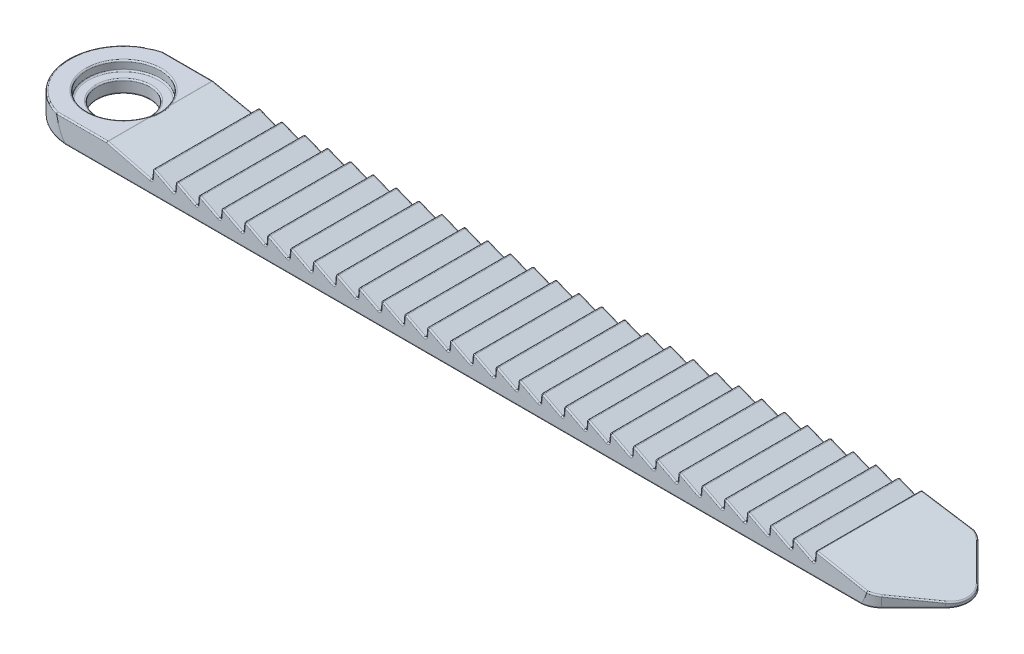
SolidWorks part; units mm, degrees
ref_plane "Face" through (0, 0, 0) normal (0, 0, 1) x (1, 0, 0)
ref_plane "Dessus" through (0, 0, 0) normal (0, 1, 0) x (1, 0, 0)
ref_plane "Droite" through (0, 0, 0) normal (1, 0, 0) x (0, 0, -1)
sketch "Esquisse1" plane through (0, 0, 0) normal (0, 1, 0) x (1, 0, 0)
  line L0 (-22.5776, 0) -> (227.4274, 0) construction
  line L1 (0, 12) -> (172.9289, 12)
  line L2 (176.4645, 10.5355) -> (183.4645, 3.5355)
  line L3 (0, -12) -> (172.9289, -12)
  line L4 (183.4645, -3.5355) -> (176.4645, -10.5355)
  arc A0 (0, 12) -> (0, -12) centre (0, 0) ccw
  arc A1 (183.4645, 3.5355) -> (183.4645, -3.5355) centre (179.9289, 0) cw
  arc A2 (172.9289, 12) -> (176.4645, 10.5355) centre (172.9289, 7) cw
  arc A3 (172.9289, -12) -> (176.4645, -10.5355) centre (172.9289, -7) ccw
  point P11 (187, 0)
  point P14 (175, 12)
  point P17 (175, -12)
  dimension "D3" = 5
  dimension "D1" = 24
  dimension "D2" = 175
extrude "Extrusion1" add sketch "Esquisse1" along normal blind 4.8
sketch "Esquisse2" plane through (0, 0, 0) normal (0, 0, 1) x (1, 0, 0)
  line L0 (8, 4.8) -> (18, 2.5)
  line L1 (0, 4.8) -> (172.9289, 4.8) construction
  line L2 (18, 2.5) -> (18, 4.8)
  line L3 (0, 0) -> (172.9289, 0) construction
  line L4 (8, 4.8) -> (18, 4.8)
  dimension "D1" = 8
  dimension "D2" = 10
  dimension "D3" = 2.5
extrude "Extrusion2" cut sketch "Esquisse2" against normal through all and the other way through all
sketch "Esquisse3" plane through (0, 0, 0) normal (0, 0, 1) x (1, 0, 0)
  line L0 (18, 4.8) -> (172.9289, 4.8) construction
  line L1 (18, 4.8) -> (23, 4.8)
  line L2 (18, 4.8) -> (23, 2.5)
  line L3 (23, 2.5) -> (23, 4.8)
  line L4 (18, 2.5) -> (18, 4.8) construction
  dimension "D1" = 5
extrude "Extrusion3" cut sketch "Esquisse3" against normal through all and the other way through all
pattern_linear "Répétition linéaire1" count 29 spacing 5 along (1, 0, 0) of "Extrusion3"
sketch "Esquisse6" plane through (0, 0, 0) normal (0, 0, 1) x (1, 0, 0)
  line L0 (163, 4.8) -> (184.9289, 1)
  line L1 (184.9289, 0) -> (184.9289, 4.8) construction
  line L2 (176.4645, 0) -> (183.4645, 0) construction
  line L3 (163, 4.8) -> (184.9289, 4.8)
  line L4 (184.9289, 4.8) -> (184.9289, 1)
  dimension "D1" = 1
extrude "Extrusion4" cut sketch "Esquisse6" against normal through all and the other way through all
sketch "Esquisse7" plane through (0, 0, 0) normal (1, 0, 0) x (0, 0, -1)
  line L0 (12, 0) -> (11.5801, 4.8)
  line L1 (-12, 0) -> (-11.5801, 4.8)
  line L2 (12, 4.8) -> (-12, 4.8) construction
  line L3 (12, 4.8) -> (11.5801, 4.8)
  line L4 (12, 4.8) -> (12, 0) construction
  line L5 (12, 4.8) -> (12, 0)
  line L6 (-12, 4.8) -> (-12, 0) construction
  line L7 (-12, 4.8) -> (-12, 0)
  line L8 (-11.5801, 4.8) -> (-12, 4.8)
  dimension "D1" = 5
  dimension "D2" = 5
extrude "Extrusion5" cut sketch "Esquisse7" against normal through all and the other way through all
hole_wizard "Perçage1" positions "Esquisse9" profile "Esquisse8" legacy
sketch "Esquisse9" plane through (0, 4.8, 0) normal (0, 1, 0) x (-1, 0, 0)
  point P0 (0, 0)
sketch "Esquisse8" plane through (0, 4.8, 0) normal (1, 0, 0) x (0, 0, 1)
  line L0 (0, 0) -> (0, 8.2549)
  line L1 (0, 8.2549) -> (5.75, 4.8)
  line L2 (5.75, 4.8) -> (5.75, 2)
  line L3 (5.75, 2) -> (8, 2)
  line L4 (8, 0) -> (0, 0)
  line L5 (0, -11.3109) -> (0, 121.1557) construction
  line L6 (0, 8.2549) -> (-5.75, 4.8) construction
  line L7 (8, 2) -> (8, 0)
  dimension "Diamètre" = 11.5
  dimension "Profondeur" = 4.8
  dimension "Diamètre chambrage" = 16
  dimension "Profondeur chambrage" = 2
  dimension "Angle" = 118
fillet "Congé1" radius 0.3 9 edges at (179.9645, 0, -7.0355) (174.8423, 0, -11.6194) (86.4645, 0, -12) (-12, 0, 0) (86.4645, 0, 12) (174.8423, 0, 11.6194) (179.9645, 0, 7.0355) (184.9289, 0, 0) (0, 0, 5.75)
fillet "Congé2" radius 0.3 71 edges at (33, 3.65, 11.6807) (23, 3.65, 11.6807) (18, 3.65, 11.6807) (25.5, 3.65, 11.6807) (23, 4.8, 0) (23, 2.5, 0) (18, 2.5, 0) (123, 3.65, -11.6807) (118, 3.65, -11.6807) (113, 3.65, -11.6807) (108, 3.65, -11.6807) (108, 3.65, 11.6807) (103, 3.65, -11.6807) (103, 3.65, 11.6807) (98, 3.65, -11.6807) (83, 3.65, -11.6807) (73, 3.65, 11.6807) (63, 3.65, -11.6807) (58, 3.65, 11.6807) (53, 3.65, 11.6807) (48, 3.65, 11.6807) (43, 3.65, 11.6807) (125.5, 3.65, 11.6807) (123, 2.5, 0) (105.5, 3.65, -11.6807) (108, 2.5, 0) (105.5, 3.65, 11.6807) (100.5, 3.65, -11.6807) (100.5, 3.65, 11.6807) (98, 4.8, 0) (98, 2.5, 0) (95.5, 3.65, 11.6807) (93, 4.8, 0) (93, 2.5, 0) (85.5, 3.65, 11.6807) (78, 4.8, 0) (78, 2.5, 0) (73, 4.8, 0) (65.5, 3.65, 11.6807) (60.5, 3.65, -11.6807) (63, 2.5, 0) (60.5, 3.65, 11.6807) (58, 4.8, 0) (55.5, 3.65, -11.6807) (53, 2.5, 0) (43, 4.8, 0) (40.5, 3.65, -11.6807) (38, 4.8, 0) (35.5, 3.65, -11.6807) (35.5, 3.65, 11.6807) (33, 4.8, 0) (163, 3.65, 11.6807) (158, 3.65, -11.6807) (148, 3.65, -11.6807) (143, 3.65, 11.6807) (138, 3.65, -11.6807) (133, 3.65, -11.6807) (175.5431, 2.6264, 11.2622) (160.5, 3.65, -11.6807) (160.5, 3.65, 11.6807) (158, 4.8, 0) (148, 4.8, 0) (145.5, 3.65, -11.6807) (145.5, 3.65, 11.6807) (140.5, 3.65, -11.6807) (143, 2.5, 0) (140.5, 3.65, 11.6807) (138, 4.8, 0) (130.5, 3.65, -11.6807) (128, 4.8, 0) (163, 4.8, 0)
fillet "Congé3" radius 0.3 8 edges at (7.9998, 4.7981, -11.3383) (7.9998, 4.7981, 11.3383) (-12, 4.8, 0) (1.8142, 4.8, -11.5801) (-8, 4.8, 0) (1.8142, 4.8, 11.5801) (0, 2.8, 8) (0, 2.8, 5.75)
